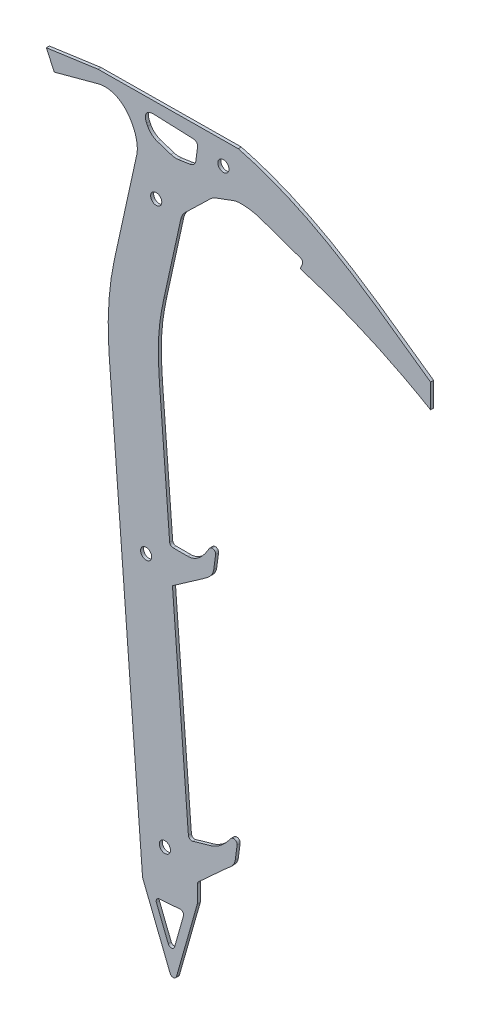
SolidWorks part; units mm, degrees
ref_plane "Front Plane" through (0, 0, 0) normal (0, 0, 1) x (1, 0, 0)
ref_plane "Top Plane" through (0, 0, 0) normal (0, 1, 0) x (1, 0, 0)
ref_plane "Right Plane" through (0, 0, 0) normal (1, 0, 0) x (0, 0, -1)
other "Bounding Box"
ref_plane "Default Plane" through (-85.2228, 232.448, 0) normal (0.9878, 0.1558, 0) x (0, 0, -1)
sketch "Sketch2" plane through (0, 0, 0) normal (0, 0, 1) x (1, 0, 0)
  line L0 (31.0095, -409.0266) -> (50.3129, 200.2677) construction
  line L1 (44.6721, -347.3042) -> (13.607, 57.9067) construction
  line L2 (6.6836, -350.2166) -> (44.6721, -347.3042) construction
  line L3 (-24.3815, 54.9944) -> (6.6836, -350.2166)
  line L4 (33.3675, 188.6776) -> (17.033, 114.249)
  line L5 (-3.5959, 197.9884) -> (-20.611, 120.4586)
  line L6 (-33.0001, 230.1938) -> (-66.1198, 221.2764)
  line L7 (-78.5559, 217.928) -> (-85.2148, 232.4492) construction
  line L8 (-33.0001, 239.7742) -> (73.4154, 240.7486)
  line L9 (-72.0877, 234.2908) -> (-33.0001, 239.7742)
  line L10 (38.1922, 193.0982) -> (70.0858, 204.9113)
  line L11 (219.3152, 142.1325) -> (219.3152, 160.4223)
  line L12 (219.3152, 142.1325) -> (120.4435, 185.4637) construction
  line L13 (120.4435, 185.4637) -> (123.1802, 191.7081)
  line L14 (123.1802, 191.7081) -> (90.0064, 203.3731)
  line L15 (9.9641, 231.3514) -> (39.2147, 230.1938)
  line L16 (3.9087, 222.8328) -> (10.3233, 210.1062)
  line L17 (42.6016, 226.4763) -> (41.2161, 216.4695)
  line L18 (14.0181, 208.772) -> (36.5462, 212.2102)
  line L19 (27.4053, -122.0771) -> (13.607, 57.9067)
  line L20 (48.1647, -347.0365) -> (30.3446, -409.6333)
  line L21 (30.3446, -409.6333) -> (6.6836, -350.2166)
  line L22 (27.4053, -122.0771) -> (40.9199, -122.0771)
  line L23 (62.4635, -107.5319) -> (60.6474, -121.0144)
  line L24 (29.3333, -147.226) -> (52.7557, -130.9017)
  line L25 (62.4635, -107.5319) -> (58.0169, -107.5319)
  line L26 (29.3333, -147.226) -> (41.6789, -308.2607)
  line L27 (25.6779, -348.7604) -> (30.3446, -409.6333) construction
  line L28 (15.9069, -358.2248) -> (38.6961, -356.4777)
  line L29 (15.9069, -358.2248) -> (28.906, -390.8676)
  line L30 (28.906, -390.8676) -> (38.6961, -356.4777)
  line L31 (-72.0877, 234.2908) -> (-66.1198, 221.2764)
  line L32 (48.1647, -332.6989) -> (48.1647, -347.0365)
  line L33 (-85.2148, 232.4492) -> (-72.0877, 234.2908) construction
  line L34 (41.6789, -308.2607) -> (58.0169, -303.5819)
  line L35 (78.7824, -290.1774) -> (76.9664, -303.6598)
  line L36 (48.1647, -332.6989) -> (69.0747, -313.5472)
  line L37 (78.7824, -290.1774) -> (74.3358, -290.1774)
  line L38 (-66.1198, 221.2764) -> (-78.5559, 217.928) construction
  spline S0 degree 3 poles (-24.3815, 54.9944) (-26.1546, 78.1223) (-25.1036, 99.9878) (-20.611, 120.4586) knots 0 0 0 0 1 1 1 1
  spline S1 degree 3 poles (17.033, 114.249) (11.9648, 91.1558) (12.1688, 76.6671) (13.607, 57.9067) knots 0 0 0 0 1 1 1 1
  spline S2 degree 3 poles (-33.0001, 230.1938) (-27.1367, 231.7726) (-14.9868, 229.4205) (-4.2882, 214.5639) (-2.5291, 202.8493) (-3.5959, 197.9884) knots 0 0 0 0 0.318927 0.707776 1 1 1 1
  spline S3 degree 3 poles (33.3675, 188.6776) (33.8997, 191.1028) (36.1468, 192.3406) (38.1922, 193.0982) knots 0 0 0 0 1 1 1 1
  spline S4 degree 3 poles (219.3152, 160.4223) (171.7359, 194.0829) (130.1784, 225.9646) (73.4154, 240.7486) knots 0 0 0 0 1 1 1 1
  spline S5 degree 2 poles (219.3152, 142.1325) (171.6775, 170.1277) (120.4435, 185.4637) knots 0 0 0 1 1 1
  spline S6 degree 3 poles (70.0858, 204.9113) (74.2686, 206.4606) (83.7236, 205.5824) (90.0064, 203.3731) knots 0 0 0 0 1 1 1 1
  spline S7 degree 3 poles (3.9087, 222.8328) (2.3406, 225.9438) (1.8537, 231.6724) (9.9641, 231.3514) knots 0 0 0 0 1 1 1 1
  spline S8 degree 3 poles (39.2147, 230.1938) (41.862, 230.0891) (42.8331, 228.1483) (42.6016, 226.4763) knots 0 0 0 0 1 1 1 1
  spline S9 degree 3 poles (10.3233, 210.1062) (10.9127, 208.9369) (12.1452, 208.4861) (14.0181, 208.772) knots 0 0 0 0 1 1 1 1
  spline S10 degree 3 poles (36.5462, 212.2102) (39.4356, 212.6512) (40.9271, 214.3826) (41.2161, 216.4695) knots 0 0 0 0 1 1 1 1
  spline S11 degree 2 poles (58.0169, -107.5319) (50.1965, -122.0771) (40.9199, -122.0771) knots 0 0 0 1 1 1
  spline S12 degree 3 poles (60.6474, -121.0144) (60.0315, -125.5867) (56.2153, -128.4905) (52.7557, -130.9017) knots 0 0 0 0 1 1 1 1
  spline S15 degree 2 poles (74.3358, -290.1774) (66.935, -301.028) (58.0169, -303.5819) knots 0 0 0 1 1 1
  spline S16 degree 3 poles (76.9664, -303.6598) (76.3505, -308.2322) (72.1843, -310.699) (69.0747, -313.5472) knots 0 0 0 0 1 1 1 1
  dimension "D1" = 609.6
  dimension "D2" = 38.1
  dimension "D3" = 406.4
  dimension "D4" = 406.4
  dimension "D5" = 76.2
  dimension "D6" = 79.375
  dimension "D7" = 38.1
  dimension "D8" = 107.95
  dimension "D9" = 18.2898
  dimension "D10" = 12.7
extrude "Boss-Extrude1" add sketch "Sketch2" along normal mid plane 2.286
fillet "Fillet1" radius 2.54 15 edges at (123.1802, 191.7081, 0) (-33.0001, 239.7742, 0) (6.6836, -350.2166, 0) (30.3446, -409.6333, 0) (48.1647, -347.0365, 0) (48.1647, -332.6989, 0) (41.6789, -308.2607, 0) (74.3358, -290.1774, 0) (78.7824, -290.1774, 0) (27.4053, -122.0771, 0) (58.0169, -107.5319, 0) (62.4635, -107.5319, 0) (28.906, -390.8676, 0) (15.9069, -358.2248, 0) (38.6961, -356.4777, 0)
sketch "Sketch6" plane through (0, 0, 1.143) normal (0, 0, 1) x (1, 0, 0)
  line L0 (-21.7757, 21.0043) -> (16.2128, 23.9167)
  line L1 (-24.3815, 54.9944) -> (6.654, -349.8306) construction
  line L2 (27.2255, -119.7313) -> (13.607, 57.9067) construction
  line L3 (16.2128, 23.9167) -> (22.0375, -52.0604)
  line L4 (22.0375, -52.0604) -> (-15.951, -54.9727)
  line L5 (-15.951, -54.9727) -> (-21.7757, 21.0043)
  line L6 (35.0607, -356.7564) -> (19.3502, -357.9608) construction
  dimension "D1" = 76.2
  dimension "D2" = 304.8
extrude "Cut-Extrude1" cut sketch "Sketch6" against normal through all both and the other way through all
move or copy body "Body-Move/Copy1" bodies to move or copy 103 copy no translate (5.8247, -75.9771, 0)
combine bodies "Combine1" operation type add bodies to combine 107 113
sketch "Sketch8" plane through (0, 0, 1.143) normal (0, 0, 1) x (1, 0, 0)
  line L0 (59.9637, 123.0277) -> (36.4698, 100.2958)
  line L1 (44.0169, 117.1211) -> (75.9105, 128.9343) construction
  line L2 (22.8577, 38.2719) -> (39.1922, 112.7006) construction
  line L3 (36.4698, 100.2958) -> (39.1922, 112.7006)
  line L4 (44.0169, 117.1211) -> (59.9637, 123.0277)
  line L5 (9.7334, 146.8558) -> (16.148, 134.1292) construction
  line L6 (19.8428, 132.7949) -> (42.3709, 136.2332) construction
  line L7 (12.9407, 140.4925) -> (16.148, 134.1292)
  line L8 (19.8428, 132.7949) -> (31.1069, 134.5141)
  line L9 (12.9407, 140.4925) -> (31.1069, 134.5141)
  spline S0 degree 3 poles (1839.0207, -757.1988) (-1871.9811, 864.5832) (1999.0847, -533.9288) (-1868.3496, 702.148) knots -9.000867 -9.000867 -9.000867 -9.000867 10.994632 10.994632 10.994632 10.994632 only from (39.1922, 112.7006) to (44.0169, 117.1211) construction
  spline S1 degree 3 poles (39.1922, 112.7006) (39.7245, 115.1258) (41.9715, 116.3635) (44.0169, 117.1211) knots 0 0 0 0 1 1 1 1
  spline S2 degree 3 poles (1484.1796, 1485.4007) (-460.001, 60.0598) (-405.8009, -749.5395) (1246.2208, 1709.7648) knots -27.50692 -27.50692 -27.50692 -27.50692 25.241817 25.241817 25.241817 25.241817 only from (16.148, 134.1292) to (19.8428, 132.7949) construction
  spline S3 degree 3 poles (16.148, 134.1292) (16.7374, 132.9599) (17.9699, 132.5091) (19.8428, 132.7949) knots 0 0 0 0 1 1 1 1
  dimension "D1" = 12.7
extrude "Boss-Extrude4" add sketch "Sketch8" against normal up to surface (2.286 mm away)
fillet "Fillet2" radius 12.7 4 edges at (36.4698, 100.2958, 0) (59.9637, 123.0277, 0) (31.1069, 134.5141, 0) (12.9407, 140.4925, 0)
hole_wizard "5/16 Clearance Hole1" positions "Sketch9" profile "Sketch10" hole size "5/16" standard "ANSI Inch"
sketch "Sketch9" plane through (0, 0, -1.143) normal (0, 0, -1) x (-1, 0, 0)
  point P0 (-68.0092, 147.7417)
  point P3 (-17.0415, 100.6382)
  point P6 (-9.3819, -136.1974)
  point P9 (-23.6115, -321.8072)
sketch "Sketch10" plane through (68.0092, 147.7417, -1.143) normal (1, 0, 0) x (0, 1, 0)
  line L0 (0, 0) -> (0, 2.286)
  line L1 (0, 2.286) -> (4.2164, 2.286)
  line L2 (4.2164, 2.286) -> (4.2164, 0)
  line L5 (4.2164, 0) -> (0, 0)
  line L11 (0, -6.35) -> (0, 107.95) construction
  dimension "Thru Hole Dia." = 8.4328
  dimension "Thru Hole Depth" = 2.286
